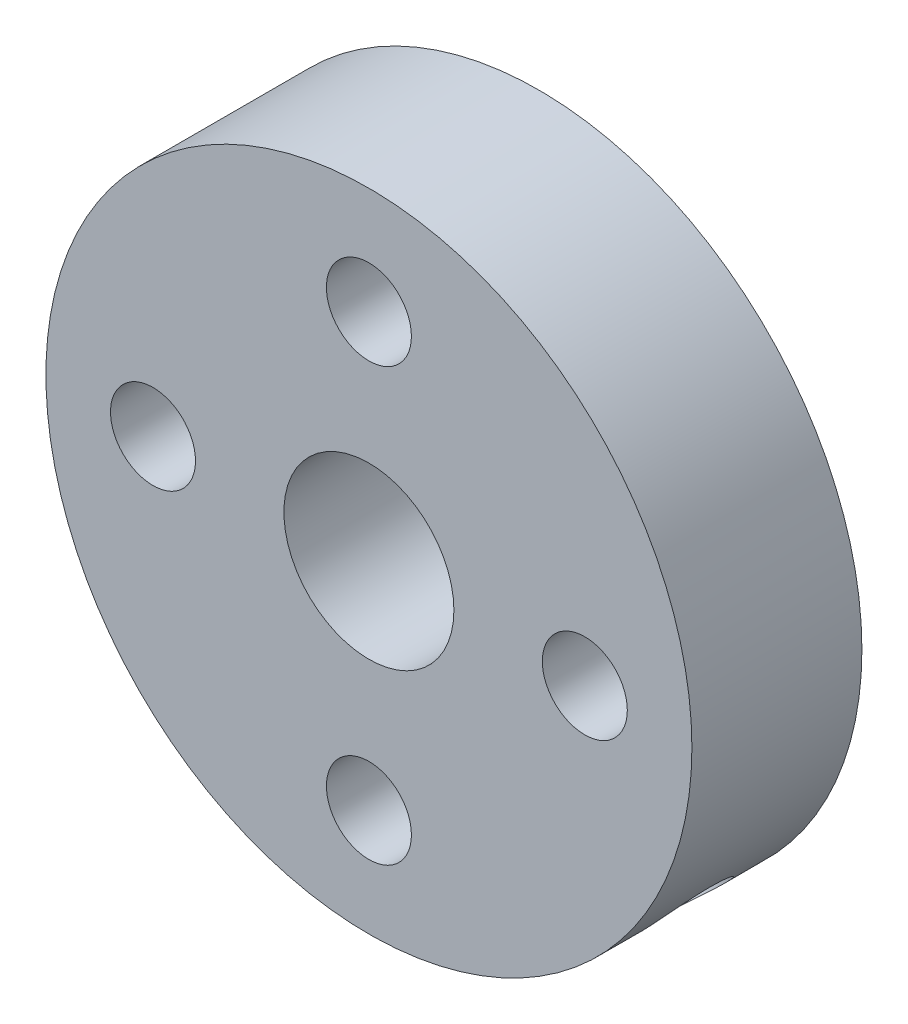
SolidWorks part; units mm, degrees
ref_plane "Front" through (0, 0, 0) normal (0, 0, 1) x (1, 0, 0)
ref_plane "Top" through (0, 0, 0) normal (0, 1, 0) x (1, 0, 0)
ref_plane "Right" through (0, 0, 0) normal (1, 0, 0) x (0, 0, -1)
sketch "Sketch1" plane through (0, 0, 0) normal (0, 0, 1) x (1, 0, 0)
  circle A0 centre (0, 0) radius 9.5
  dimension "D1" = 19
extrude "Boss-Extrude1" add sketch "Sketch1" along normal blind 5
hole_wizard "Ø5.0 (5) Diameter Hole1" positions "Sketch2" profile "Sketch3" hole size "Ø5.0" standard "ANSI Metric"
sketch "Sketch2" plane through (0, 0, 5) normal (0, 0, 1) x (1, 0, 0)
  point P0 (0, 0)
sketch "Sketch3" plane through (0, 0, 5) normal (1, 0, 0) x (0, -1, 0)
  line L0 (0, 0) -> (0, 5)
  line L1 (0, 5) -> (2.5, 5)
  line L2 (2.5, 5) -> (2.5, 0)
  line L5 (2.5, 0) -> (0, 0)
  line L11 (0, -6.35) -> (0, 107.95) construction
  dimension "Thru Hole Dia." = 5
  dimension "Thru Hole Depth" = 5
hole_wizard "M3x0.5 Tapped Hole1" positions "Sketch4" profile "Sketch5" tap size "M3x0.5" standard "ANSI Metric"
sketch "Sketch4" plane through (0, 0, 5) normal (0, 0, 1) x (1, 0, 0)
  line L0 (0, 0) -> (6.35, 0) construction
  line L2 (0, 0) -> (0, 6.35) construction
  point P0 (6.35, 0)
  point P11 (0, -6.35)
  point P12 (-6.35, 0)
  point P13 (0, 6.35)
  point P14 (0, 0)
  dimension "D1" = 6.35
  dimension "D2" = 4
sketch "Sketch5" plane through (6.35, 0, 5) normal (1, 0, 0) x (0, -1, 0)
  line L0 (0, 0) -> (0, 5)
  line L1 (0, 5) -> (1.25, 5)
  line L2 (1.25, 5) -> (1.25, 0)
  line L5 (1.25, 0) -> (0, 0)
  line L11 (0, -6.35) -> (0, 107.95) construction
  dimension "Thru Tap Drill Dia." = 2.5
  dimension "Thru Tap Drill Depth" = 5
ref_plane "Plane1" through (0, 0, 0) normal (0.7071, 0.7071, 0) x (0, 0, -1)
ref_plane "Plane2" through (6.7175, -6.7175, 0) normal (0.7071, -0.7071, 0) x (-0.7071, -0.7071, 0)
hole_wizard "M3x0.5 Tapped Hole4" positions "Sketch8" profile "Sketch9" tap size "M3x0.5" standard "ANSI Metric"
sketch "Sketch8" plane through (6.7175, -6.7175, 0) normal (0.7071, -0.7071, 0) x (-0.7071, -0.7071, 0)
  line L0 (0, -5) -> (0, 0) construction
  point P0 (0, -2.5)
sketch "Sketch9" plane through (6.7175, -6.7175, 2.5) normal (0, 0, 1) x (0.7071, 0.7071, 0)
  line L0 (0, 0) -> (0, 7)
  line L1 (0, 7) -> (1.25, 7)
  line L2 (1.25, 7) -> (1.25, 0)
  line L5 (1.25, 0) -> (0, 0)
  line L11 (0, -6.35) -> (0, 107.95) construction
  dimension "Thru Tap Drill Dia." = 2.5
  dimension "Thru Tap Drill Depth" = 7
